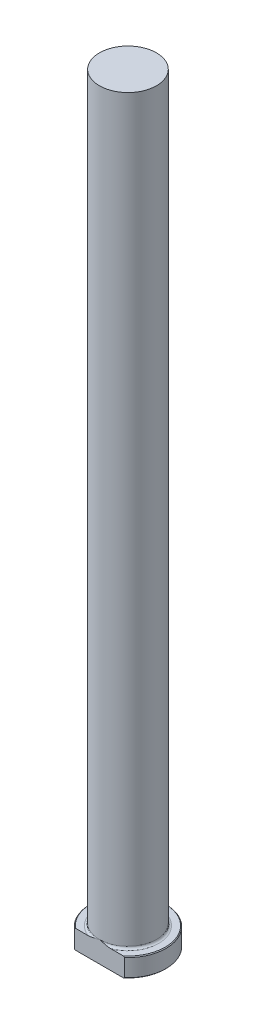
SolidWorks part; units mm, degrees
ref_plane "Front Plane" through (0, 0, 0) normal (0, 0, 1) x (1, 0, 0)
ref_plane "Top Plane" through (0, 0, 0) normal (0, 1, 0) x (1, 0, 0)
ref_plane "Right Plane" through (0, 0, 0) normal (1, 0, 0) x (0, 0, -1)
sketch "Sketch1" plane through (0, 0, 0) normal (0, 0, 1) x (1, 0, 0)
  line L0 (0, 259.9588) -> (0, -15.1925) construction
  line L1 (0, 0) -> (-12.7, 0)
  line L2 (-12.7, 0) -> (-12.7, 6.35)
  line L3 (-12.7, 6.35) -> (-9.525, 6.35)
  line L4 (-9.525, 6.35) -> (-9.525, 254)
  line L5 (-9.525, 254) -> (0, 254)
  line L6 (0, 254) -> (0, 0)
  dimension "L" = 254
  dimension "H" = 25.4
  dimension "T" = 6.35
  dimension "D" = 19.05
revolve "Revolve1" add sketch "Sketch1" angle 360 about L0
chamfer "Chamfer1" distance 0.254 angle 45 2 edges at (0, 6.35, 12.7) (0, 0, 12.7)
fillet "Fillet1" radius 0.762 1 edges at (0, 6.35, 9.525)
sketch "Sketch2" plane through (0, 0, 0) normal (0, -1, 0) x (1, 0, 0)
  line L0 (-8.4003, 9.525) -> (8.4003, 9.525)
  arc A0 (8.4003, 9.525) -> (-8.4003, 9.525) centre (0, 0) ccw
  circle A1 centre (0, 0) radius 12.7 construction
  circle A3 centre (0, 0) radius 9.525 construction
extrude "KEY" cut sketch "Sketch2" against normal through all
sketch "Pocket Sketch" plane through (0, 0, 0) normal (0, 0, 1) x (1, 0, 0)
  line L0 (-13.0969, 0) -> (-13.0969, 6.3754)
  line L1 (-13.0969, 6.3754) -> (-10.6839, 6.3754)
  line L2 (-9.9219, 7.1374) -> (-9.9219, 22.225)
  line L3 (-9.9219, 22.225) -> (0, 22.225)
  line L4 (0, 22.225) -> (0, 0)
  line L5 (0, 0) -> (-13.0969, 0)
  line L6 (0, 12.6104) -> (0, -2.4989) construction
  line L7 (-12.7, 6.096) -> (-12.7, 0.254) construction
  line L8 (12.446, 6.35) -> (-12.446, 6.35) construction
  line L9 (-9.525, 254) -> (-9.525, 7.112) construction
  line L10 (-10.6839, 6.3754) -> (-9.9219, 7.1374)
  point P3 (-9.9219, 6.3754)
  dimension "D1" = 26.1937
  dimension "D2" = 0.3969
  dimension "D3" = 0.0254
  dimension "D4" = 0.3969
  dimension "D5" = 19.8437
  dimension "D6" = 22.225
